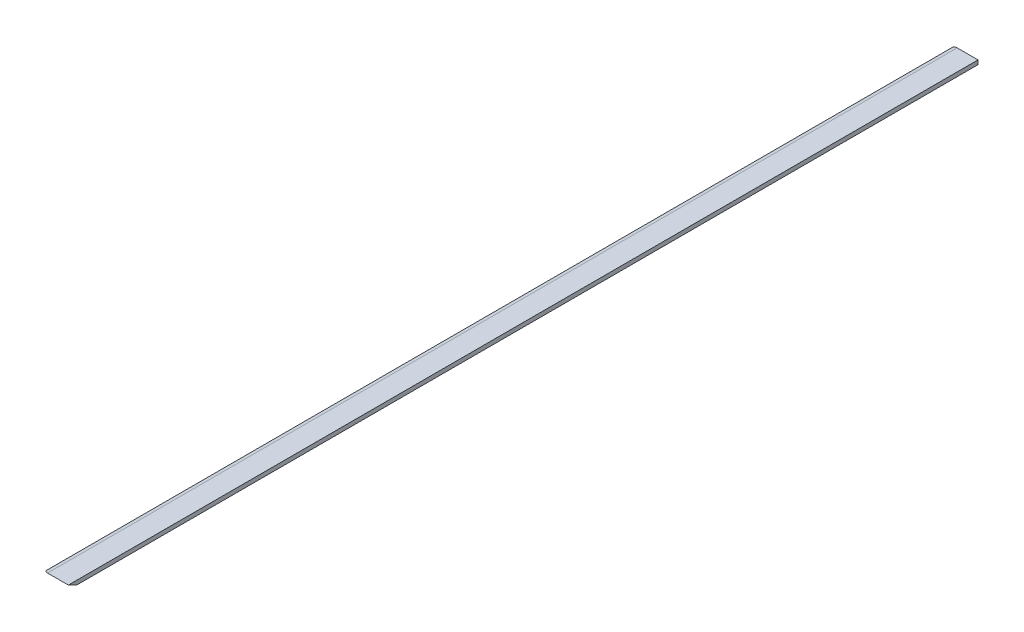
SolidWorks part; units mm, degrees
ref_plane "Plan de face" through (0, 0, 0) normal (0, 0, 1) x (1, 0, 0)
ref_plane "Plan de dessus" through (0, 0, 0) normal (0, 1, 0) x (1, 0, 0)
ref_plane "Plan de droite" through (0, 0, 0) normal (1, 0, 0) x (0, 0, -1)
sketch "Esquisse1" plane through (0, 0, 0) normal (0, 0, 1) x (1, 0, 0)
  line L0 (0, 0) -> (0, 60)
  line L1 (20, 80) -> (80, 80)
  line L2 (80, 80) -> (80, 68)
  line L3 (80, 68) -> (20, 68)
  line L4 (12, 60) -> (12, 0)
  line L5 (12, 0) -> (0, 0)
  arc A0 (0, 60) -> (20, 80) centre (20, 60) cw
  arc A1 (20, 68) -> (12, 60) centre (20, 60) ccw
  point P9 (0, 80)
  dimension "D5" = 20
  dimension "D6" = 8
  dimension "D1" = 80
  dimension "D2" = 80
  dimension "D3" = 12
  dimension "D4" = 12
extrude "Extrusion1" add sketch "Esquisse1" along normal blind 2750
sketch "Esquisse3" plane through (0, 0, 0) normal (-1, 0, 0) x (0, 0, 1)
  line L0 (2750, 0) -> (2750, 140)
  line L1 (2750, 140) -> (2450, 0)
  line L2 (2750, 0) -> (0, 0) construction
  line L3 (2450, 0) -> (2750, 0)
  dimension "D1" = 140
  dimension "D2" = 300
extrude "Enlèv. mat.-Extru.2" cut sketch "Esquisse3" against normal blind 100
